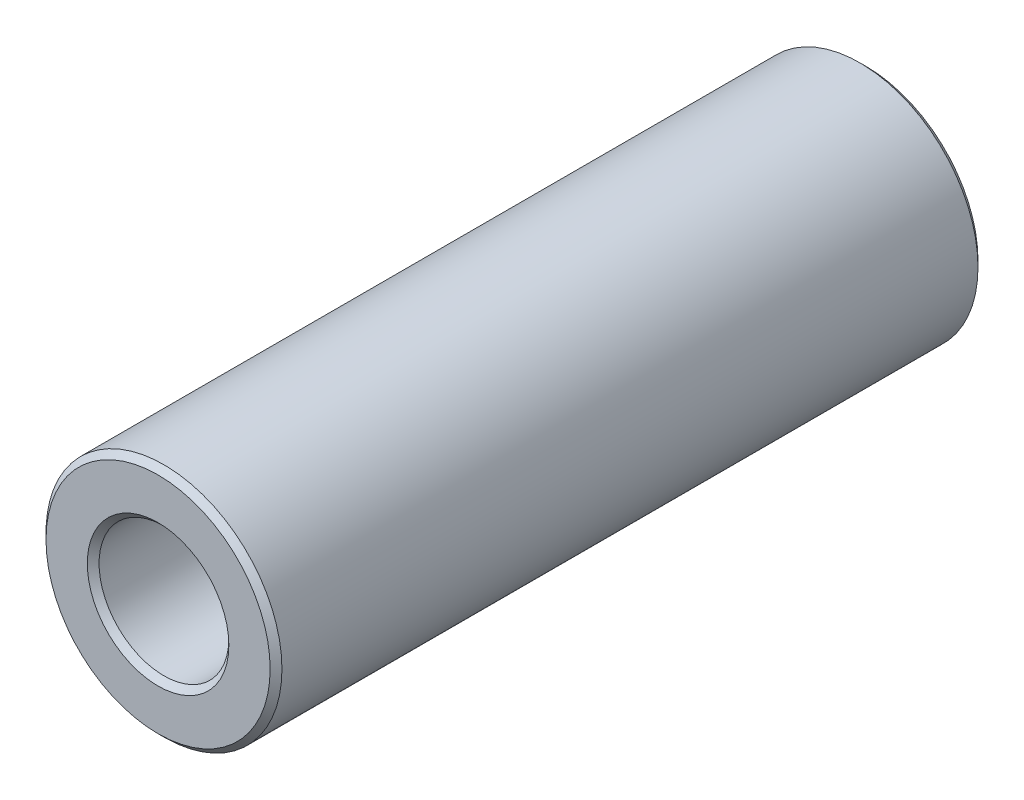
SolidWorks part; units mm, degrees
ref_plane "Front Plane" through (0, 0, 0) normal (0, 0, 1) x (1, 0, 0)
ref_plane "Top Plane" through (0, 0, 0) normal (0, 1, 0) x (1, 0, 0)
ref_plane "Right Plane" through (0, 0, 0) normal (1, 0, 0) x (0, 0, -1)
sketch "Sketch1" plane through (0, 0, 0) normal (0, 0, 1) x (1, 0, 0)
  circle A0 centre (0, 0) radius 2
  circle A1 centre (0, 0) radius 1.1
  dimension "D1" = 4
  dimension "D2" = 2.2
extrude "Boss-Extrude2" add sketch "Sketch1" along normal mid plane 12
chamfer "Chamfer3" distance 0.1 angle 45 4 edges at (2, 0, 6) (2, 0, -6) (1.1, 0, -6) (1.1, 0, 6)
